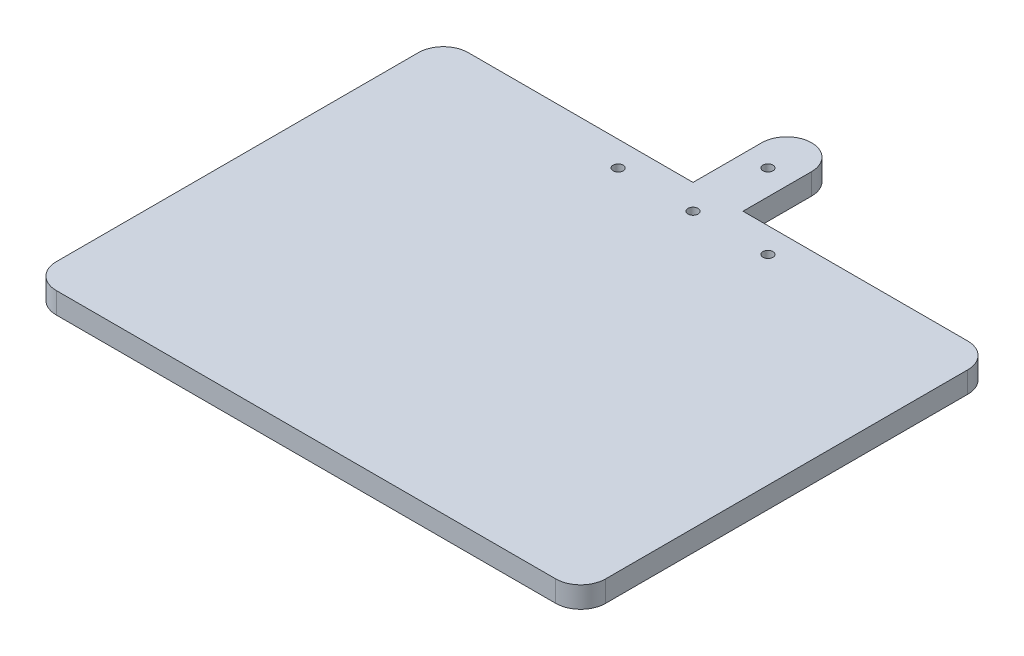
SolidWorks part; units mm, degrees
ref_plane "Front" through (0, 0, 0) normal (0, 0, 1) x (1, 0, 0)
ref_plane "Top" through (0, 0, 0) normal (0, 1, 0) x (1, 0, 0)
ref_plane "Right" through (0, 0, 0) normal (1, 0, 0) x (0, 0, -1)
sketch "Sketch1" plane through (0, 0, 0) normal (1, 0, 0) x (0, 0, -1)
  line L0 (0, 0) -> (0, -8.5)
  line L1 (0, -8.5) -> (67.49, -8.5)
  line L2 (67.49, -8.5) -> (67.49, 160.5)
  line L3 (67.49, 160.5) -> (27.987, 160.5)
  line L4 (27.987, 160.5) -> (27.987, 70)
  line L5 (27.987, 70) -> (47.49, 70)
  line L6 (47.49, 70) -> (47.49, 0)
  line L7 (47.49, 0) -> (0, 0)
  line L8 (50, 0) -> (-50, 0) construction
  line L9 (0, 50) -> (0, -50) construction
  dimension "D1" = 8.5
  dimension "D3" = 27.987
  dimension "D4" = 70
  dimension "D5" = 90.5
  dimension "D6" = 67.49
  dimension "D7" = 20
extrude "Boss-Extrude1" add sketch "Sketch1" along normal mid plane 25
hole_wizard "#55 (0.052) Diameter Hole1" positions "Sketch2" profile "Sketch3" hole size "#55" standard "ANSI Inch"
sketch "Sketch2" plane through (0, 0, -27.987) normal (0, 0, 1) x (1, 0, 0)
  line L0 (0, 77.5) -> (0, 92.5) construction
  line L1 (0, 92.5) -> (0, 107.5) construction
  line L2 (0, 107.5) -> (0, 122.5) construction
  line L4 (0, -50) -> (0, 50) construction
  line L5 (12.5, 70) -> (-12.5, 70) construction
  point P0 (0, 77.5)
  point P2 (0, 92.5)
  point P4 (0, 107.5)
  point P6 (0, 122.5)
  point P20 (0, 137.5)
  point P21 (0, 152.5)
  dimension "D1" = 15
  dimension "D2" = 7.5
  dimension "D3" = 15
  dimension "D4" = 15
sketch "Sketch3" plane through (0, 77.5, -27.987) normal (1, 0, 0) x (0, -1, 0)
  line L0 (0, 0) -> (0, 10.3968)
  line L1 (0, 10.3968) -> (0.6604, 10)
  line L2 (0.6604, 10) -> (0.6604, 0)
  line L5 (0.6604, 0) -> (0, 0)
  line L10 (0, 10.3968) -> (-0.6604, 10) construction
  line L11 (0, -6.35) -> (0, 107.95) construction
  dimension "Hole Dia." = 1.3208
  dimension "Hole Depth" = 10
  dimension "Drill Angle" = 118
sketch "Sketch4" plane through (0, 0, 0) normal (0, 1, 0) x (1, 0, 0)
  line L1 (-100, 67.4905) -> (100, 67.4905)
  line L2 (-110, 57.4905) -> (-110, -87.5095)
  line L3 (-100, -97.5095) -> (100, -97.5095)
  line L4 (110, 57.4905) -> (110, -87.5095)
  line L5 (0, 0) -> (0, 131.3458) construction
  arc A0 (-110, -87.5095) -> (-100, -97.5095) centre (-100, -87.5095) ccw
  arc A1 (100, -97.5095) -> (110, -87.5095) centre (100, -87.5095) ccw
  arc A2 (100, 67.4905) -> (110, 57.4905) centre (100, 57.4905) cw
  arc A3 (-100, 67.4905) -> (-110, 57.4905) centre (-100, 57.4905) ccw
  point P0 (0, 67.4905)
  point P11 (110, -97.5095)
  point P14 (110, 67.4905)
  point P17 (-110, 67.4905)
  dimension "D1" = 220
  dimension "D4" = 10
  dimension "D2" = 165
extrude "Boss-Extrude4" add sketch "Sketch4" against normal up to surface (8.5 mm away)
sketch "Sketch5" plane through (0, 70, 0) normal (0, -1, 0) x (1, 0, 0)
  line L0 (0, -50) -> (0, 50) construction
  line L1 (-12.5, -47.49) -> (12.5, -47.49)
  line L2 (-12.5, -47.49) -> (-12.5, -24.987)
  line L3 (-12.5, -24.987) -> (12.5, -24.987)
  line L4 (12.5, -47.49) -> (12.5, -24.987)
  line L5 (-12.5, -47.49) -> (12.5, -24.987) construction
  line L6 (-12.5, -24.987) -> (12.5, -47.49) construction
  line L7 (12.5, -27.987) -> (12.5, -47.49) construction
  line L8 (12.5, -47.49) -> (-12.5, -47.49) construction
  line L9 (12.5, -27.987) -> (-12.5, -27.987) construction
  point P0 (0, -36.2385)
  dimension "D1" = 3
extrude "Boss-Extrude5" add sketch "Sketch5" along normal blind 2
sketch "Sketch6" plane through (0, 160.5, 0) normal (0, 1, 0) x (1, 0, 0)
  line L0 (12.5, 67.49) -> (-12.5, 67.49) construction
  line L4 (12.5, 47.49) -> (-12.5, 47.49)
  line L5 (12.5, 24.987) -> (12.5, 47.49)
  line L6 (-12.5, 24.987) -> (12.5, 24.987)
  line L7 (-12.5, 47.49) -> (-12.5, 24.987)
  line L8 (12.5, 67.49) -> (-12.5, 67.49)
  line L9 (12.5, 24.987) -> (12.5, 67.49)
  line L10 (-12.5, 24.987) -> (12.5, 24.987)
  line L11 (-12.5, 67.49) -> (-12.5, 24.987)
  dimension "D1" = 0
extrude "Boss-Extrude6" add sketch "Sketch6" along normal blind 2
fillet "Fillet1" radius 5 1 edges at (0, 68, -47.49)
sketch "Sketch7" plane through (12.5, 0, 0) normal (1, 0, 0) x (0, 0, -1)
  line L0 (67.49, 0) -> (67.49, 162.5) construction
  line L1 (27.987, 160.5) -> (67.49, 160.5)
  line L2 (27.987, 160.5) -> (27.987, 150.5)
  line L3 (27.987, 150.5) -> (67.49, 150.5)
  line L4 (67.49, 160.5) -> (67.49, 150.5)
  line L5 (27.987, 160.5) -> (27.987, 70) construction
  line L6 (24.987, 162.5) -> (67.49, 162.5) construction
  dimension "D1" = 2
  dimension "D2" = 10
extrude "Boss-Extrude7" add sketch "Sketch7" along normal blind 3
sketch "Sketch8" plane through (0, 0, -27.987) normal (0, 0, 1) x (1, 0, 0)
  line L0 (15.5, 158) -> (14, 158)
  line L1 (14, 158) -> (14, 159)
  line L5 (14, 152) -> (14, 153)
  line L6 (14, 153) -> (15.5, 153)
  line L7 (15.5, 153) -> (15.5, 158)
  line L8 (12.5, 155.5) -> (15.5, 155.5) construction
  line L9 (15.5, 160.5) -> (15.5, 150.5) construction
  line L12 (14, 158) -> (14, 153) construction
  line L13 (14, 159) -> (10, 159)
  line L14 (10, 159) -> (10, 152)
  line L15 (10, 152) -> (14, 152)
  point P14 (15.5, 155.5)
  dimension "D1" = 1.5
  dimension "D2" = 4
  dimension "D3" = 5
sketch "Sketch9" plane through (0, 0, -67.49) normal (0, 0, -1) x (-1, 0, 0)
  line L0 (12.5, 0) -> (12.5, 162.5) construction
  line L1 (-12.5, 162.5) -> (12.5, 162.5)
  line L2 (-12.5, 162.5) -> (-12.5, 160.5)
  line L3 (-12.5, 160.5) -> (12.5, 160.5)
  line L4 (12.5, 162.5) -> (12.5, 160.5)
  line L5 (-15.5, 160.5) -> (-12.5, 160.5) construction
extrude "Boss-Extrude8" add sketch "Sketch9" along normal blind 3
sketch "Sketch10" plane through (0, 0, -67.49) normal (0, 0, -1) x (-1, 0, 0)
  line L0 (-12.5, 0) -> (-12.5, 150.5) construction
  line L1 (-12.5, 70) -> (12.5, 70)
  line L2 (-12.5, 70) -> (-12.5, 68)
  line L3 (-12.5, 68) -> (12.5, 68)
  line L4 (12.5, 70) -> (12.5, 68)
  line L5 (12.5, 0) -> (12.5, 160.5) construction
  line L7 (-12.5, 160.5) -> (12.5, 160.5) construction
  dimension "D1" = 2
  dimension "D2" = 90.5
extrude "Boss-Extrude9" add sketch "Sketch10" along normal blind 3
sketch "Sketch11" plane through (0, 0, -67.49) normal (0, 0, -1) x (-1, 0, 0)
  line L0 (12.5, 70) -> (-12.5, 70) construction
  point P0 (0, 77.5)
  point P1 (0, 92.5)
  point P2 (0, 107.5)
  point P3 (0, 122.5)
  point P4 (0, 137.5)
  point P5 (0, 152.5)
  dimension "D1" = 7.5
  dimension "D2" = 15
  dimension "D3" = 15
  dimension "D4" = 15
  dimension "D5" = 15
  dimension "D6" = 15
hole_wizard "#55 (0.052) Diameter Hole2" positions "Sketch12" profile "Sketch13" hole size "#55" standard "ANSI Inch"
sketch "Sketch12" plane through (0, 0, -67.49) normal (0, 0, -1) x (-1, 0, 0)
  point P0 (0, 77.5)
  point P3 (0, 92.5)
  point P6 (0, 107.5)
  point P9 (0, 122.5)
  point P12 (0, 137.5)
  point P15 (0, 152.5)
sketch "Sketch13" plane through (0, 77.5, -67.49) normal (1, 0, 0) x (0, 1, 0)
  line L0 (0, 0) -> (0, 10.3968)
  line L1 (0, 10.3968) -> (0.6604, 10)
  line L2 (0.6604, 10) -> (0.6604, 0)
  line L5 (0.6604, 0) -> (0, 0)
  line L10 (0, 10.3968) -> (-0.6604, 10) construction
  line L11 (0, -6.35) -> (0, 107.95) construction
  dimension "Hole Dia." = 1.3208
  dimension "Hole Depth" = 10
  dimension "Drill Angle" = 118
sketch "Sketch19" plane through (0, 0, -67.49) normal (0, 0, -1) x (-1, 0, 0)
  line L0 (-12.5, 68) -> (-52.9003, 0)
  line L1 (-52.9003, 0) -> (-12.5, 0)
  line L2 (-12.5, 0) -> (12.5, 0) construction
  line L3 (-12.5, 0) -> (-12.5, 68)
  line L4 (0, 68) -> (0, 0) construction
  line L5 (52.9003, 0) -> (12.5, 0)
  line L6 (12.5, 68) -> (52.9003, 0)
  line L7 (12.5, 0) -> (12.5, 68)
extrude "Extrude-Thin1" add sketch "Sketch19" against normal blind 20 thin
sketch "Sketch20" plane through (0, 0, -67.49) normal (0, 0, -1) x (-1, 0, 0)
  line L0 (-12.5, 68) -> (12.5, 68) construction
  line L1 (-10, 68) -> (10, 68)
  line L2 (-10, 68) -> (-10, 0)
  line L4 (10, 68) -> (10, 0)
  line L6 (-10, 0) -> (10, 0)
  line L7 (-52.9003, 0) -> (52.9003, 0) construction
  dimension "D1" = 20
  dimension "D2" = 2.5
extrude "Boss-Extrude11" add sketch "Sketch20" along normal blind 43
sketch "Sketch22" plane through (10, 0, 0) normal (1, 0, 0) x (0, 0, -1)
  line L1 (67.49, 68) -> (104.9772, 0)
  line L4 (104.9772, 68) -> (67.49, 68)
  line L6 (110.49, 0) -> (67.4905, 0) construction
  line L7 (104.9772, 68) -> (110.49, 68)
  line L8 (110.49, 68) -> (110.49, 0) construction
  line L9 (110.49, 68) -> (70.49, 68) construction
  line L10 (110.49, 68) -> (110.49, 0)
  line L11 (110.49, 0) -> (104.9772, 0)
extrude "Cut-Extrude4" cut sketch "Sketch22" against normal blind 43
sketch "Sketch24" plane through (10, 0, 0) normal (1, 0, 0) x (0, 0, -1)
  line L0 (72.49, 47.9007) -> (72.49, 0)
  line L2 (98.8968, 0) -> (72.49, 47.9007)
  line L3 (67.49, 68) -> (104.9772, 0) construction
  line L4 (67.49, 68) -> (67.49, 0) construction
  line L6 (72.49, 0) -> (98.8968, 0)
  line L7 (104.9772, 0) -> (67.4905, 0) construction
  dimension "D1" = 0
  dimension "D2" = 5
extrude "Cut-Extrude5" cut sketch "Sketch24" against normal blind 43
sketch "Sketch12" plane through (0, 0, -67.4905) normal (0, 0, -1) x (-1, 0, 0)
  line L0 (100, -8.5) -> (-100, -8.5) construction
  line L1 (-10, 0) -> (10, 0)
  line L2 (-10, 0) -> (-10, -8.5)
  line L3 (-10, -8.5) -> (10, -8.5)
  line L4 (10, 0) -> (10, -8.5)
  line L5 (10, 0) -> (10, 68) construction
extrude "Boss-Extrude13" add sketch "Sketch12" along normal blind 37.5
sketch "Sketch13" plane through (0, 0, -72.49) normal (0, 0, -1) x (-1, 0, 0)
  line L0 (10, 47.9007) -> (10, 0) construction
  line L1 (-10, 0) -> (10, 0)
  line L2 (-10, 0) -> (-10, 5)
  line L3 (-10, 5) -> (10, 5)
  line L4 (10, 0) -> (10, 5)
  line L5 (-44.1138, 5) -> (-17.5, 5) construction
extrude "Boss-Extrude14" add sketch "Sketch13" along normal up to next
fillet "Fillet4" radius 10 2 edges at (10, -4.25, -104.9905) (-10, -4.25, -104.9905)
sketch "Sketch28" plane through (0, 162.5, 0) normal (0, 1, 0) x (1, 0, 0)
  line L0 (12.5, 24.987) -> (12.5, 70.49) construction
  line L2 (12.5, 27.987) -> (12.5, 67.49)
  line L4 (-12.5, 27.987) -> (-12.5, 67.49)
  line L5 (15.5, 27.987) -> (12.5, 27.987) construction
  line L6 (-52.9003, 67.49) -> (-12.5, 67.49) construction
  line L7 (-12.5, 70.49) -> (-12.5, 24.987) construction
  line L8 (-12.5, 24.987) -> (12.5, 24.987)
  line L9 (12.5, 24.987) -> (12.5, 27.987)
  line L10 (-12.5, 24.987) -> (-12.5, 27.987)
  line L11 (-12.5, 67.49) -> (-12.5, 70.49)
  line L12 (-12.5, 70.49) -> (12.5, 70.49)
  line L13 (12.5, 70.49) -> (12.5, 67.49)
extrude "Boss-Extrude15" add sketch "Sketch28" along normal blind 30
sketch "Sketch36" plane through (12.5, 0, 0) normal (1, 0, 0) x (0, 0, -1)
  line L0 (24.987, 192.5) -> (70.49, 192.5) construction
  line L1 (70.49, 192.5) -> (70.49, 160.5) construction
  circle A0 centre (65.49, 189.5) radius 15
  dimension "D1" = 30
  dimension "D2" = 3
  dimension "D3" = 5
extrude "Cut-Extrude8" cut sketch "Sketch36" against normal blind 16.65
sketch "Sketch37" plane through (-12.5, 0, 0) normal (-1, 0, 0) x (0, 0, 1)
  line L0 (-24.987, 192.5) -> (-24.987, 160.5) construction
  line L1 (-70.49, 192.5) -> (-24.987, 192.5) construction
  circle A0 centre (-29.987, 189.5) radius 15
  dimension "D1" = 30
  dimension "D2" = 5
  dimension "D3" = 3
extrude "Cut-Extrude9" cut sketch "Sketch37" against normal blind 16.65
sketch "Sketch38" plane through (4.15, 0, 0) normal (-1, 0, 0) x (0, 0, 1)
  line L1 (-44.6839, 192.5) -> (-24.987, 192.5) construction
  line L2 (-24.987, 175.3579) -> (-24.987, 192.5) construction
  point P0 (-29.987, 189.5)
  dimension "D1" = 5
  dimension "D2" = 3
hole_wizard "#8-36 Tapped Hole1" positions "Sketch39" profile "Sketch40" tap size "#8-36" standard "ANSI Inch"
sketch "Sketch39" plane through (4.15, 0, 0) normal (-1, 0, 0) x (0, 0, 1)
  point P0 (-29.987, 189.5)
sketch "Sketch40" plane through (4.15, 189.5, -29.987) normal (0, 1, 0) x (0, 0, 1)
  line L0 (0, 0) -> (0, 8.35)
  line L1 (0, 8.35) -> (1.7272, 8.35)
  line L2 (1.7272, 8.35) -> (1.7272, 0)
  line L5 (1.7272, 0) -> (0, 0)
  line L11 (0, -6.35) -> (0, 107.95) construction
  dimension "Thru Tap Drill Dia." = 3.4544
  dimension "Thru Tap Drill Depth" = 8.35
sketch "Sketch41" plane through (-4.15, 0, 0) normal (1, 0, 0) x (0, 0, -1)
  line L0 (50.7931, 192.5) -> (70.49, 192.5) construction
  line L2 (70.49, 192.5) -> (70.49, 175.3579) construction
  point P0 (65.49, 189.5)
  dimension "D1" = 3
  dimension "D2" = 5
hole_wizard "#8-32 Tapped Hole1" positions "Sketch44" profile "Sketch43" tap size "#8-32" standard "ANSI Inch"
sketch "Sketch44" plane through (-4.15, 0, 0) normal (1, 0, 0) x (0, 0, -1)
  point P0 (65.49, 189.5)
sketch "Sketch43" plane through (-4.15, 189.5, -65.49) normal (0, 1, 0) x (0, 0, -1)
  line L0 (0, 0) -> (0, 8.35)
  line L1 (0, 8.35) -> (1.7272, 8.35)
  line L2 (1.7272, 8.35) -> (1.7272, 0)
  line L5 (1.7272, 0) -> (0, 0)
  line L11 (0, -6.35) -> (0, 107.95) construction
  dimension "Thru Tap Drill Dia." = 3.4544
  dimension "Thru Tap Drill Depth" = 8.35
fillet "Fillet6" radius 3 2 edges at (-8.325, 192.5, -70.49) (8.325, 192.5, -24.987)
extrude "Cut-Extrude10" cut sketch "Sketch8" against normal blind 32
sketch "Sketch45" plane through (0, 160.5, 0) normal (0, 1, 0) x (1, 0, 0)
  line L0 (15.5, 67.49) -> (15.5, 27.987) construction
  line L1 (12.5, 27.987) -> (15.5, 27.987)
  line L2 (12.5, 27.987) -> (12.5, 29.987)
  line L3 (12.5, 29.987) -> (15.5, 29.987)
  line L4 (15.5, 27.987) -> (15.5, 29.987)
  dimension "D1" = 2
extrude "Cut-Extrude11" cut sketch "Sketch45" against normal up to surface (10 mm away)
sketch "Sketch46" plane through (-4.15, 0, 0) normal (1, 0, 0) x (0, 0, -1)
  circle A0 centre (65.49, 189.5) radius 3
  circle A1 centre (65.49, 189.5) radius 1.7272
  dimension "D1" = 6
fillet "Fillet10" radius 2 4 edges at (-4.175, 192.5, -44.6839) (-4.175, 175.3579, -24.987) (4.175, 192.5, -50.7931) (4.175, 175.3579, -70.49)
sketch "Sketch47" plane through (4.15, 0, 0) normal (-1, 0, 0) x (0, 0, 1)
  circle A0 centre (-29.987, 189.5) radius 3
  circle A1 centre (-29.987, 189.5) radius 1.7272
  dimension "D1" = 6
extrude "Boss-Extrude18" add sketch "Sketch47" along normal blind 1
sketch "Sketch48" plane through (-4.15, 0, 0) normal (1, 0, 0) x (0, 0, -1)
  circle A0 centre (65.49, 189.5) radius 1.7272
  circle A1 centre (65.49, 189.5) radius 2.38
  dimension "D1" = 4.76
extrude "Boss-Extrude19" add sketch "Sketch48" along normal blind 1
extrude "Boss-Extrude17" add sketch "Sketch46" along normal blind 1
sketch "Sketch49" plane through (12.5, 0, 0) normal (1, 0, 0) x (0, 0, -1)
  line L0 (29.987, 150.5) -> (67.49, 150.5) construction
  line L1 (31.987, 146.5) -> (63.49, 146.5)
  line L2 (31.987, 146.5) -> (31.987, 72)
  line L3 (31.987, 72) -> (63.49, 72)
  line L4 (63.49, 146.5) -> (63.49, 72)
  line L5 (47.49, 68) -> (67.49, 68) construction
  line L6 (67.49, 70) -> (67.49, 150.5) construction
  line L7 (27.987, 152) -> (27.987, 70) construction
  dimension "D1" = 4
  dimension "D2" = 4
  dimension "D3" = 4
  dimension "D4" = 4
extrude "Cut-Extrude12" cut sketch "Sketch49" against normal blind 5
mirror "Mirror1" about plane through (0, 0, 0) normal (1, 0, 0) of "Cut-Extrude12"
fillet "Fillet11" radius 3 8 edges at (-10, 146.5, -31.987) (-10, 146.5, -63.49) (-10, 72, -31.987) (-10, 72, -63.49) (10, 72, -31.987) (10, 72, -63.49) (10, 146.5, -63.49) (10, 146.5, -31.987)
sketch "Sketch50" plane through (0, 0, 0) normal (0, 1, 0) x (1, 0, 0)
  line L0 (52.9003, 47.49) -> (52.9003, 67.49) construction
  line L1 (-52.9003, -6.3463) -> (52.9003, -6.3463)
  line L2 (-52.9003, -6.3463) -> (-52.9003, 113.3166)
  line L3 (-52.9003, 113.3166) -> (52.9003, 113.3166)
  line L4 (52.9003, -6.3463) -> (52.9003, 113.3166)
  line L5 (-52.9003, 47.49) -> (-52.9003, 67.49) construction
extrude "Cut-Extrude13" cut sketch "Sketch50" along normal through all
sketch "Sketch51" plane through (0, -8.5, 0) normal (0, -1, 0) x (1, 0, 0)
  line L0 (-100, -67.4905) -> (-10, -67.4905) construction
  line L1 (10, -67.4905) -> (100, -67.4905) construction
  point P0 (0, -57.4905)
  point P1 (-30, -57.4905)
  point P2 (30, -57.4905)
  point P3 (0, -87.4905)
  dimension "D1" = 10
  dimension "D2" = 10
  dimension "D3" = 10
  dimension "D4" = 30
  dimension "D5" = 30
  dimension "D6" = 30
hole_wizard "Ø4.0mm Dowel Hole1" positions "Sketch52" profile "Sketch54" hole size "Ø4.0" standard "ANSI Metric"
sketch "Sketch52" plane through (0, -8.5, 0) normal (0, -1, 0) x (-1, 0, 0)
  point P0 (30, 57.4905)
  point P3 (0, 57.4905)
  point P6 (-30, 57.4905)
  point P9 (0, 87.4905)
sketch "Sketch54" plane through (-30, -8.5, -57.4905) normal (1, 0, 0) x (0, 0, -1)
  line L0 (0, 0) -> (0, 8.5)
  line L1 (0, 8.5) -> (2, 8.5)
  line L2 (2, 8.5) -> (2, 0)
  line L5 (2, 0) -> (0, 0)
  line L11 (0, -6.35) -> (0, 107.95) construction
  dimension "Thru Hole Dia." = 4
  dimension "Thru Hole Depth" = 8.5
sketch "Sketch55" plane through (0, -8.5, 0) normal (0, -1, 0) x (1, 0, 0)
  circle A0 centre (0, -57.4905) radius 4
  circle A1 centre (-30, -57.4905) radius 4
  circle A2 centre (30, -57.4905) radius 4
  circle A3 centre (0, -87.4905) radius 4
  dimension "D1" = 8
extrude "Cut-Extrude14" cut sketch "Sketch55" against normal blind 2.5
sketch "Sketch56" plane through (0, -8.5, 0) normal (0, -1, 0) x (1, 0, 0)
  point P0 (-117.6523, 93.0217)
  point P1 (118.7648, 93.0217)
  point P2 (118.7648, -59.9541)
  point P3 (-117.6523, -59.9541)
  point P4 (-117.6523, 19.8715)
  point P5 (118.7648, 19.8715)
  point P6 (43.3895, 93.0217)
  point P7 (-37.8267, 93.0217)
  point P8 (0, -99.1715)
  point P9 (0, -66.6294)
